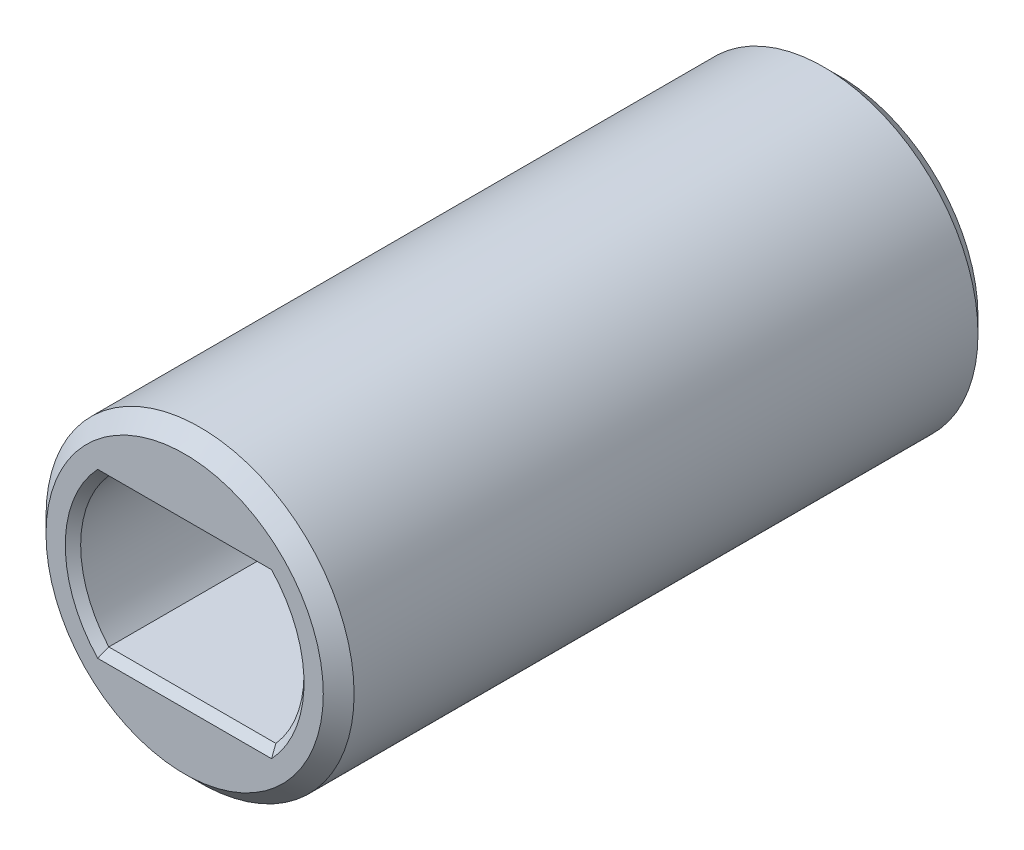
SolidWorks part; units mm, degrees
ref_plane "Přední rovina" through (0, 0, 0) normal (0, 0, 1) x (1, 0, 0)
ref_plane "Horní rovina" through (0, 0, 0) normal (0, 1, 0) x (1, 0, 0)
ref_plane "Pravá rovina" through (0, 0, 0) normal (1, 0, 0) x (0, 0, -1)
sketch "Skica1" plane through (0, 0, 0) normal (0, 0, 1) x (1, 0, 0)
  line L0 (-5.0761, 0) -> (4.8847, 0) construction
  line L1 (-2.169, 1.925) -> (2.169, 1.925)
  line L2 (-2.169, -1.925) -> (2.169, -1.925)
  line L3 (-5.9628, 5.3333) -> (-1.4907, 10.3333) construction
  line L4 (0, 4.24) -> (0, -1.5529) construction
  line L5 (5.9628, 5.3333) -> (1.4907, 10.3333) construction
  arc A0 (-2.169, 1.925) -> (-2.169, -1.925) centre (0, 0) ccw
  arc A1 (2.169, -1.925) -> (2.169, 1.925) centre (0, 0) ccw
  arc A2 (-5.9628, 5.3333) -> (5.9628, 5.3333) centre (0, 0) ccw construction
  arc A3 (1.4907, 10.3333) -> (-1.4907, 10.3333) centre (0, 9) ccw construction
  circle A4 centre (0, 0) radius 4
  dimension "D1" = 2.9
  dimension "D3" = 8
  dimension "D4" = 2
  dimension "D5" = 11
  dimension "D6" = 8
  dimension "D2" = 3.85
extrude "Přidat vysunutím1" add sketch "Skica1" along normal blind 8.4
sketch "Skica2" plane through (0, 0, 0) normal (0, 0, -1) x (-1, 0, 0)
  circle A1 centre (0, 0) radius 4
  circle A2 centre (0, 0) radius 4
  dimension "D1" = 0
extrude "Přidat vysunutím2" add sketch "Skica2" along normal blind 8.6
sketch "Skica3" plane through (0, 0, -8.6) normal (0, 0, -1) x (-1, 0, 0)
  circle A0 centre (0, 0) radius 1.9
  dimension "D1" = 3.8
extrude "Odebrat vysunutím1" cut sketch "Skica3" against normal blind 7
sketch "Skica4" plane through (0, 0, -1.6) normal (0, 0, -1) x (-1, 0, 0)
  line L0 (-2.2936, 0) -> (2.9704, 0) construction
  line L1 (-1.5492, 1.1) -> (1.5492, 1.1)
  line L2 (-1.5492, -1.1) -> (1.5492, -1.1)
  circle A1 centre (0, 0) radius 1.9 construction
  arc A2 (-1.5492, -1.1) -> (1.5492, -1.1) centre (0, 0) ccw
  arc A3 (1.5492, 1.1) -> (-1.5492, 1.1) centre (0, 0) ccw
  dimension "D1" = 2.2
chamfer "Zkosení2" distance 0.2 angle 45 5 edges at (2.9, 0, 8.4) (0, -1.925, 8.4) (0, 1.925, 8.4) (-2.9, 0, 8.4) (-1.9, 0, -8.6)
chamfer "Zkosení3" distance 0.4 angle 45 2 edges at (-4, 0, -8.6) (4, 0, 8.4)
extrude "Přidat vysunutím3" add sketch "Skica4" along normal blind 5.2
